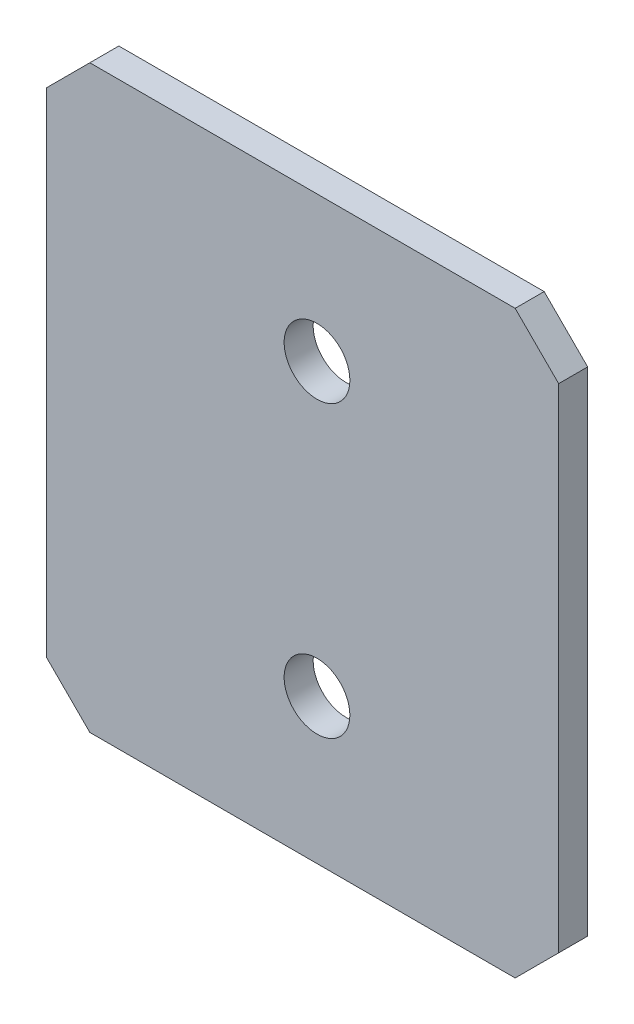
SolidWorks part; units mm, degrees
ref_plane "Plan de face" through (0, 0, 0) normal (0, 0, 1) x (1, 0, 0)
ref_plane "Plan de dessus" through (0, 0, 0) normal (0, 1, 0) x (1, 0, 0)
ref_plane "Plan de droite" through (0, 0, 0) normal (1, 0, 0) x (0, 0, -1)
sketch "Esquisse1" plane through (0, 0, 0) normal (0, 0, 1) x (1, 0, 0)
  line L1 (0, 0) -> (53, 0)
  line L2 (0, 0) -> (0, 60)
  line L3 (0, 60) -> (53, 60)
  line L4 (53, 0) -> (53, 60)
  dimension "D1" = 53
  dimension "D2" = 60
extrude "Extrusion1" add sketch "Esquisse1" along normal blind 3
sketch "Esquisse2" plane through (0, 0, 3) normal (0, 0, 1) x (1, 0, 0)
  line L0 (28, 60) -> (28, 0) construction
  line L1 (53, 60) -> (0, 60) construction
  line L2 (0, 0) -> (53, 0) construction
  line L3 (53, 45) -> (0, 45) construction
  line L4 (53, 0) -> (53, 60) construction
  line L5 (0, 60) -> (0, 0) construction
  line L6 (53, 15) -> (0, 15) construction
  point P14 (28, 45)
  point P15 (28, 15)
  dimension "D1" = 25
  dimension "D2" = 15
  dimension "D3" = 15
hole_wizard "Trou taraudé M81" positions "Esquisse3D1" profile "Esquisse3" tap size "M8" standard "ISO"
sketch3d "Esquisse3D1"
  point P0 (28, 45, 3)
  point P3 (28, 15, 3)
sketch "Esquisse3" plane through (28, 45, 3) normal (1, 0, 0) x (0, -1, 0)
  line L0 (0, 0) -> (0, 21.7929)
  line L1 (0, 21.7929) -> (3.4, 19.75)
  line L2 (3.4, 19.75) -> (3.4, 0)
  line L5 (3.4, 0) -> (0, 0)
  line L10 (0, 21.7929) -> (-3.4, 19.75) construction
  line L11 (0, -6.35) -> (0, 107.95) construction
  dimension "Diamètre du trou pour taraudage" = 6.8
  dimension "Profondeur du trou pour taraudage" = 19.75
  dimension "Angle de pointe" = 118
chamfer "Chanfrein1" distance 4.5 angle 45 4 edges at (0, 60, 1.5) (53, 60, 1.5) (53, 0, 1.5) (0, 0, 1.5)
